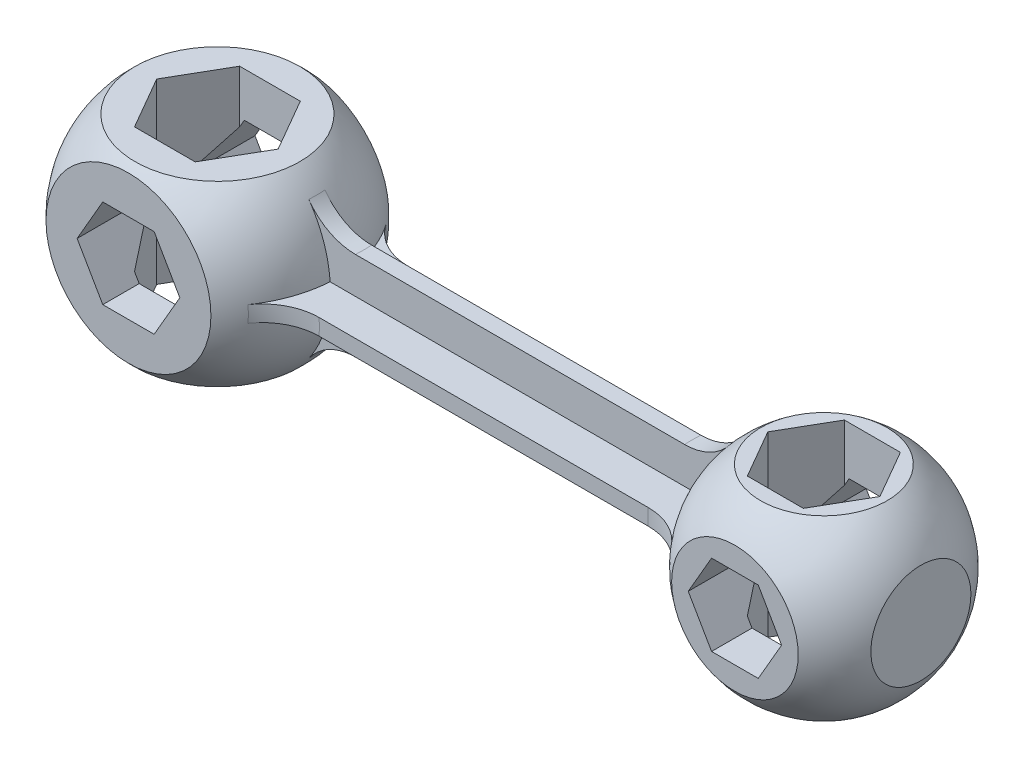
SolidWorks part; units mm, degrees
ref_plane "Front" through (0, 0, 0) normal (0, 0, 1) x (1, 0, 0)
ref_plane "Top" through (0, 0, 0) normal (0, 1, 0) x (1, 0, 0)
ref_plane "Right" through (0, 0, 0) normal (1, 0, 0) x (0, 0, -1)
sketch "Layout" plane through (0, 0, 0) normal (0, 0, 1) x (1, 0, 0)
  line L0 (0, 0) -> (75, 0) construction
  dimension "D1" = 75
ref_plane "end plane" through (75, 0, 0) normal (1, 0, 0) x (0, 0, -1)
sketch "Sketch2" plane through (0, 0, 0) normal (0, 1, 0) x (1, 0, 0)
  line L0 (-15, 0) -> (15, 0)
  line L1 (0, 0) -> (75, 0) construction
  line L2 (-15, 0) -> (-19.2461, 0) construction
  arc A0 (15, 0) -> (-15, 0) centre (0, 0) ccw
  dimension "D1" = 30
revolve "largesphere" add sketch "Sketch2" angle 360 about L2
sketch "Sketch3" plane through (0, 0, 0) normal (1, 0, 0) x (0, 0, -1)
  line L0 (0, 5.5) -> (0, -5.5)
  dimension "D1" = 11
extrude "vertcross" add sketch "Sketch3" along normal up to surface (75 mm away) thin
sketch "Sketch4" plane through (0, 0, 0) normal (1, 0, 0) x (0, 0, -1)
  line L0 (-5.5, 0) -> (5.5, 0)
  dimension "D1" = 11
extrude "horcross" add sketch "Sketch4" along normal up to surface (75 mm away) thin
sketch "Sketch5" plane through (75, 0, 0) normal (1, 0, 0) x (0, 0, -1)
  line L0 (-13.5, 0) -> (13.5, 0)
  line L2 (13.5, 0) -> (15.8649, 0) construction
  arc A0 (13.5, 0) -> (-13.5, 0) centre (0, 0) ccw
  dimension "D1" = 27
revolve "smallsphere" add sketch "Sketch5" angle 360 about L2
sketch "Sketch6" plane through (0, 0, 0) normal (0, 0, 1) x (1, 0, 0)
  line L0 (67.1738, 11) -> (82.8262, 11)
  line L1 (0, 0) -> (75, 0) construction
  line L2 (67.1738, -11) -> (82.8262, -11)
  line L4 (10.198, -11) -> (-10.198, -11)
  line L5 (10.198, 11) -> (-10.198, 11)
  arc A0 (62.6712, -5.5) -> (62.6712, 5.5) centre (75, 0) ccw construction
  arc A1 (67.1738, -11) -> (82.8262, -11) centre (75, 0) ccw
  arc A2 (82.8262, 11) -> (67.1738, 11) centre (75, 0) ccw
  arc A3 (13.9553, 5.5) -> (13.9553, -5.5) centre (0, 0) ccw construction
  arc A4 (10.198, 11) -> (-10.198, 11) centre (0, 0) ccw
  arc A5 (-10.198, -11) -> (10.198, -11) centre (0, 0) ccw
  dimension "hgt" = 11
extrude "hor cuts" cut sketch "Sketch6" against normal through all and the other way through all
sketch "Sketch16" plane through (0, 0, 0) normal (0, 1, 0) x (1, 0, 0)
  line L0 (0, 0) -> (-17.8115, 0) construction
  line L1 (-15, 0) -> (-19.2461, 0) construction
  line L2 (-10.198, 11) -> (82.8262, 11)
  line L3 (-10.198, -11) -> (82.8262, -11)
  line L8 (87, 6.1847) -> (87, -6.1847)
  line L9 (-13, 7.4833) -> (-13, -7.4833)
  arc A2 (13.9553, 5.5) -> (13.9553, -5.5) centre (0, 0) ccw construction
  arc A3 (62.6712, -5.5) -> (62.6712, 5.5) centre (75, 0) ccw construction
  arc A4 (82.8262, -11) -> (87, -6.1847) centre (75, 0) ccw
  circle A5 centre (0, 0) radius 10.198 construction
  arc A6 (87, 6.1847) -> (82.8262, 11) centre (75, 0) ccw
  arc A7 (-10.198, 11) -> (-13, 7.4833) centre (0, 0) ccw
  arc A8 (-13, -7.4833) -> (-10.198, -11) centre (0, 0) ccw
  dimension "D3" = 12
  dimension "D1" = 22
  dimension "D4" = 13
extrude "ver cuts" cut sketch "Sketch16" against normal through all and the other way through all flip side to cut
fillet "Fillet1" radius 7 8 edges at (13.9553, 0, 5.5) (13.9553, 0, -5.5) (13.9553, -5.5, 0) (62.6712, 0, 5.5) (62.6712, 5.5, 0) (62.6712, 0, -5.5) (62.6712, -5.5, 0) (13.9553, 5.5, 0)
sketch "Sketch18" plane through (0.458, 11, 1.5939) normal (0, 1, 0) x (-1, 0, 0)
  line L1 (-7.0476, -1.5939) -> (-3.2948, -8.0939)
  line L2 (-3.2948, -8.0939) -> (4.2108, -8.0939)
  line L3 (4.2108, -8.0939) -> (7.9636, -1.5939)
  line L4 (7.9636, -1.5939) -> (4.2108, 4.9061)
  line L5 (4.2108, 4.9061) -> (-3.2948, 4.9061)
  line L6 (-3.2948, 4.9061) -> (-7.0476, -1.5939)
  circle A0 centre (0.458, -1.5939) radius 6.5 construction
  circle A2 centre (0.458, -1.5939) radius 10.198 construction
  dimension "Across_Flats" = 13
extrude "Cut-Extrude2" cut sketch "Sketch18" against normal through all
sketch "Sketch19" plane through (-1.0095, 0.934, 11) normal (0, 0, 1) x (1, 0, 0)
  line L1 (-5.3413, -0.934) -> (-2.1659, -6.434)
  line L2 (-2.1659, -6.434) -> (4.185, -6.434)
  line L3 (4.185, -6.434) -> (7.3604, -0.934)
  line L4 (7.3604, -0.934) -> (4.185, 4.566)
  line L5 (4.185, 4.566) -> (-2.1659, 4.566)
  line L6 (-2.1659, 4.566) -> (-5.3413, -0.934)
  circle A0 centre (1.0095, -0.934) radius 5.5 construction
  circle A1 centre (1.0095, -0.934) radius 10.198 construction
  dimension "Across_Flats" = 11
extrude "Cut-Extrude3" cut sketch "Sketch19" against normal through all
sketch "Sketch22" plane through (75.1496, 0.2359, 11) normal (0, 0, 1) x (1, 0, 0)
  line L1 (-5.9231, -0.2359) -> (-3.0363, -5.2359)
  line L2 (-3.0363, -5.2359) -> (2.7372, -5.2359)
  line L3 (2.7372, -5.2359) -> (5.6239, -0.2359)
  line L4 (5.6239, -0.2359) -> (2.7372, 4.7641)
  line L5 (2.7372, 4.7641) -> (-3.0363, 4.7641)
  line L6 (-3.0363, 4.7641) -> (-5.9231, -0.2359)
  circle A0 centre (-0.1496, -0.2359) radius 5 construction
  circle A2 centre (-0.1496, -0.2359) radius 7.8262 construction
  dimension "Across_Flats" = 10
extrude "Cut-Extrude6" cut sketch "Sketch22" against normal through all
sketch "Sketch23" plane through (76.0169, 11, -0.409) normal (0, 1, 0) x (-1, 0, 0)
  line L1 (-5.9113, 0.409) -> (-2.4472, -5.591)
  line L2 (-2.4472, -5.591) -> (4.481, -5.591)
  line L3 (4.481, -5.591) -> (7.9451, 0.409)
  line L4 (7.9451, 0.409) -> (4.481, 6.409)
  line L5 (4.481, 6.409) -> (-2.4472, 6.409)
  line L6 (-2.4472, 6.409) -> (-5.9113, 0.409)
  circle A0 centre (1.0169, 0.409) radius 6 construction
  circle A2 centre (1.0169, 0.409) radius 7.8262 construction
  dimension "Across_Flats" = 12
extrude "Cut-Extrude7" cut sketch "Sketch23" against normal through all
